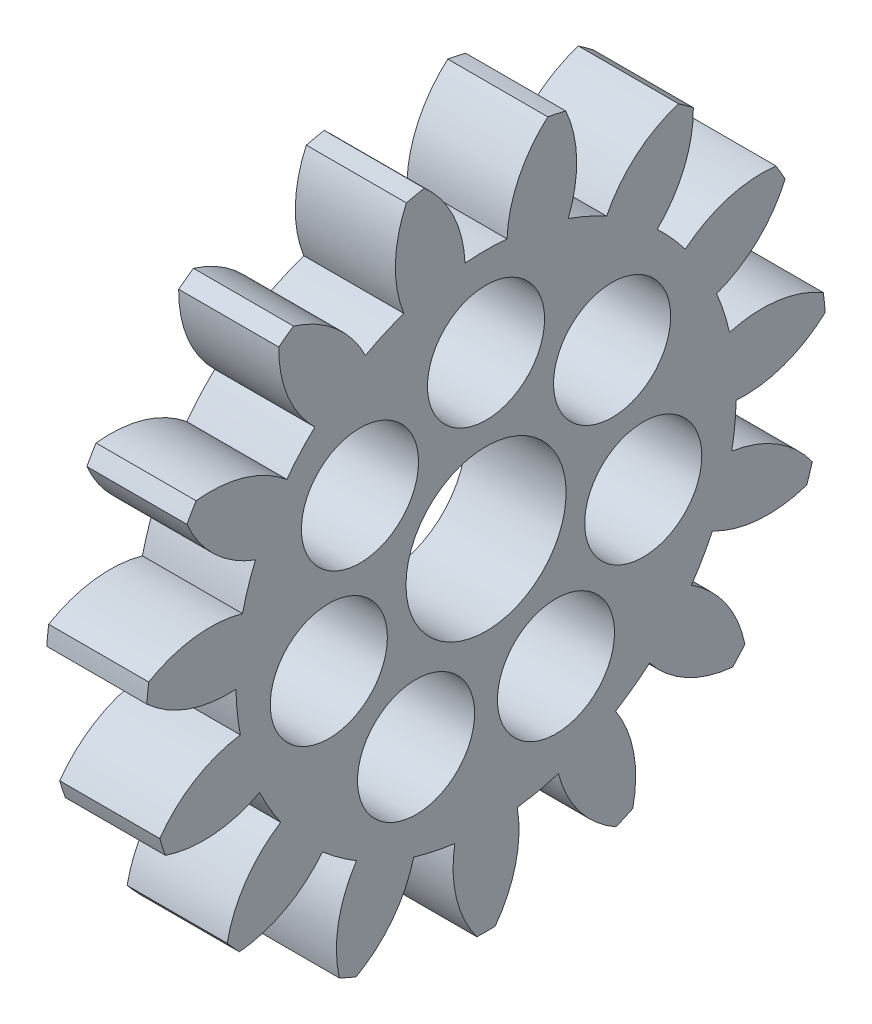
SolidWorks part; units mm, degrees
ref_plane "Plane1" through (0, 0, 0) normal (0, 0, 1) x (1, 0, 0)
ref_plane "Plane2" through (0, 0, 0) normal (0, 1, 0) x (1, 0, 0)
ref_plane "Plane3" through (0, 0, 0) normal (1, 0, 0) x (0, 0, -1)
sketch "HoldingSke" plane through (0, 0, 0) normal (0, 1, 0) x (1, 0, 0)
  line L0 (0, 0) -> (0.483, -0.1294)
  line L1 (-15, 0) -> (100, 0) construction
  line L2 (0, 0) -> (-2.1039, 2.3779)
  line L3 (0, 0) -> (-11.863, 4.5341)
  line L4 (0, 0) -> (8.3417, 2.2352)
  line L5 (0, 0) -> (-46.8476, -17.4728)
  line L6 (0, 0) -> (-4.1448, -2.7965)
  line L7 (-2.1039, 2.3779) -> (8.6586, 51.2059)
  line L8 (-76.2, 54.61) -> (-74.8, 54.61)
  line L9 (-71.009, 38.7566) -> (-53.1078, 45.2721)
  line L10 (-76.2, 71.12) -> (104.1128, 71.12)
  line L11 (0, 0) -> (-5, 0)
  line L12 (-76.2, 101.6) -> (-76.133, 101.6)
  line L13 (24.9733, 27.94) -> (52.9518, 28.4284)
  line L14 (24.9733, 27.94) -> (24.9743, 27.94)
  line L15 (24.9733, 27.94) -> (100.4006, 29.5858)
  line L16 (-63.627, -2) -> (-12.827, -2)
  circle A0 centre (0, 0) radius 4
  circle A1 centre (0, 0) radius 12.499
  circle A2 centre (0, 0) radius 37.5
  circle A3 centre (0, 0) radius 4
sketch "BasProSke" plane through (0, 0, 0) normal (0, 1, 0) x (1, 0, 0)
  line L0 (-10, 0) -> (60, 0) construction
  line L1 (0, 0) -> (0, 17)
  line L2 (0, 0) -> (5, 0)
  line L3 (5, 0) -> (5, 17)
  line L4 (5, 17) -> (0, 17)
revolve "Base-Revolve" add sketch "BasProSke" angle 360 about L0
sketch "TooCutSke" plane through (0, 0, 0) normal (1, 0, 0) x (0, 0, -1)
  line L1 (0, 0) -> (0, 107) construction
  line L2 (0, 0) -> (-1.6851, 14.905) construction
  line L3 (0, 0) -> (-6.2081, 29.2069) construction
  line L4 (-1.6851, 14.905) -> (-3.1041, 14.6034) construction
  arc A0 (1.0501, 12.4548) -> (-1.0501, 12.4548) centre (0, 0) ccw
  arc A1 (3.1109, 16.7388) -> (-3.1109, 16.7388) centre (0, 0) ccw
  circle A2 centre (0, 0) radius 15 construction
  circle A3 centre (0, 0) radius 14.0954 construction
  arc A4 (-1.0501, 12.4548) -> (-3.1109, 16.7388) centre (-7.045, 12.2085) ccw
  arc A5 (3.1109, 16.7388) -> (1.0501, 12.4548) centre (7.045, 12.2085) ccw
extrude "ToothCut" cut sketch "TooCutSke" along normal through all
fillet "Breaks" [suppressed] radius 0.04
fillet "RootFillets" [suppressed] radius 0.501
pattern_circular "TeethCuts" count 15 every 24 about axis through (-10, 0, 0) along (1, 0, 0) of "ToothCut", "RootFillets", "Breaks"
sketch "HubNeaOneSke" plane through (0, 0, 0) normal (-1, 0, 0) x (0, 0, 1)
  circle A0 centre (0, 0) radius 12.499
extrude "HubNearOne" [suppressed] add sketch "HubNeaOneSke" along normal blind 45.0001
sketch "HubNeaBotSke" plane through (0, 0, 0) normal (-1, 0, 0) x (0, 0, 1)
  circle A0 centre (0, 0) radius 12.499
extrude "HubNearBoth" [suppressed] add sketch "HubNeaBotSke" along normal blind 22.5
ref_plane "FarPln" through (5, 0, 0) normal (1, 0, 0) x (0, 0, -1)
sketch "HubFarSke" plane through (5, 0, 0) normal (1, 0, 0) x (0, 0, -1)
  circle A0 centre (0, 0) radius 12.499
extrude "HubFar" [suppressed] add sketch "HubFarSke" along normal blind 22.5
sketch "BorSke" plane through (0, 0, 0) normal (1, 0, 0) x (0, 0, -1)
  circle A0 centre (0, 0) radius 4
extrude "Bore" cut sketch "BorSke" along normal mid plane 100.0001
sketch "KeySke" plane through (0, 0, 0) normal (1, 0, 0) x (0, 0, -1)
  line L0 (-1.5, 0) -> (-1.5, 5.4)
  line L1 (-1.5, 5.4) -> (1.5, 5.4)
  line L2 (1.5, 5.4) -> (1.5, 0)
  line L3 (0, 0) -> (0, 34) construction
  line L4 (-1.5, 0) -> (1.5, 0)
extrude "Keyway" [suppressed] cut sketch "KeySke" along normal mid plane 100.0001
pattern_circular "Keyway2" [suppressed] count 2 every 90 about axis through (-10, 0, 0) along (1, 0, 0)
sketch "Esquisse1" plane through (5, 0, 0) normal (1, 0, 0) x (0, 0, -1)
  circle A0 centre (0, 8.0568) radius 2.9257
  circle A1 centre (6.299, 5.0233) radius 2.9257
  circle A2 centre (7.8548, -1.7928) radius 2.9257
  circle A3 centre (3.4957, -7.2589) radius 2.9257
  circle A4 centre (-3.4957, -7.2589) radius 2.9257
  circle A5 centre (-7.8548, -1.7928) radius 2.9257
  circle A6 centre (-6.299, 5.0233) radius 2.9257
  point P16 (0, 0)
  dimension "D1" = 7
extrude "Enlèv. mat.-Extru.1" cut sketch "Esquisse1" against normal blind 10
equation "' \"Module@HoldingSke\" = 6.35"
equation "' \"Num_teeth@HoldingSke\" = 12"
equation "' \"Ap@HoldingSke\" =  20"
equation "' \"Ap@HoldingSke\" = 20"
equation "' \"Width@HoldingSke\" = 0.5 * 25.4"
equation "' \"Hub_dia@HoldingSke\"= 1 * 25.4"
equation "' \"Hub_dia@HoldingSke\" = 1 * 25.4"
equation "' \"Overall_len@HoldingSke\" = 1.0 * 25.4"
equation "' \"Bore@HoldingSke\" = 0.75 * 25.4"
equation "' \"T_dim@HoldingSke\" = 0.1 * 25.4"
equation "' \"Width@KeySke\" = 0.25 * 25.4"
equation "' \"Show_teeth@HoldingSke\" = 13"
equation "' \"Backlash@HoldingSke\" = 0.009 * 25.4"
equation "' \"Addendum_fac@HoldingSke\" = 1.0"
equation "' \"Dedendum_fac@HoldingSke\" = 1.25"
equation "' \"Dedendum_add@HoldingSke\" = 0.00005 * 25.4"
equation "' \"Clearance_fac@HoldingSke\" = 0.25"
equation "\"Pitch@HoldingSke\" = 1 / \"Module@HoldingSke\""
equation "\"Overcut_dia@TooCutSke\" = (\"Num_teeth@HoldingSke\" + 2 * \"Addendum_fac@HoldingSke\") / \"Pitch@HoldingSke\" + 0.002 * 25.4"
equation "\"Pitch_dia@TooCutSke\" = \"Num_teeth@HoldingSke\" / \"Pitch@HoldingSke\""
equation "\"Base_dia@TooCutSke\" = \"Num_teeth@HoldingSke\" / \"Pitch@HoldingSke\" * cos((\"Ap@HoldingSke\"  * 3.14159265 / 180))"
equation "\"Root_dia@TooCutSke\" = (\"Num_teeth@HoldingSke\" + 2) / \"Pitch@HoldingSke\" - 2 * (\"Addendum_fac@HoldingSke\" + \"Dedendum_fac@HoldingSke\") / \"Pitch@HoldingSke\" - \"Dedendum_add@HoldingSke\" * 2"
equation "\"Half_ang@TooCutSke\" = 180 / \"Num_teeth@HoldingSke\""
equation "\"Half_CT@TooCutSke\" = \"Num_teeth@HoldingSke\" / \"Pitch@HoldingSke\" * sin((3.14159265 / 2 / \"Num_teeth@HoldingSke\")) / 2 - 7 * \"Backlash@HoldingSke\" / 4"
equation "\"Flank_rad@TooCutSke\" = \"Num_teeth@HoldingSke\" / \"Pitch@HoldingSke\" / 5"
equation "\"Radius@RootFillets\" = \"Clearance_fac@HoldingSke\" / \"Pitch@HoldingSke\" + \"Dedendum_add@HoldingSke\""
equation "\"Break_rad@Breaks\" = 0.02 / \"Pitch@HoldingSke\""
equation "\"Thickness@HoldingSke\" = \"Width@HoldingSke\""
equation "\"OAL@HoldingSke\" = \"Thickness@HoldingSke\""
equation "\"MHD@HoldingSke\" = (\"Num_teeth@HoldingSke\" + 2) / \"Pitch@HoldingSke\" - 2 * (\"Addendum_fac@HoldingSke\" + \"Dedendum_fac@HoldingSke\")  / \"Pitch@HoldingSke\" - \"Dedendum_add@HoldingSke\" * 2"
equation "\"MBD@HoldingSke\" = (\"Num_teeth@HoldingSke\" + 2) / \"Pitch@HoldingSke\" - 2 * (\"Addendum_fac@HoldingSke\" + \"Dedendum_fac@HoldingSke\")  / \"Pitch@HoldingSke\" - \"Dedendum_add@HoldingSke\" * 2 - 0.002 * 25.4"
equation "\"MHD@HoldingSke\" = ((sgn( \"MHD@HoldingSke\" - \"Hub_dia@HoldingSke\" )-1)*( \"MHD@HoldingSke\" - \"Hub_dia@HoldingSke\" ))/-2+ \"Hub_dia@HoldingSke\""
equation "\"MBD@HoldingSke\" = ((sgn( \"MBD@HoldingSke\" - \"Bore@HoldingSke\" )-1)*( \"MBD@HoldingSke\" - \"Bore@HoldingSke\" ))/-2+ \"Bore@HoldingSke\""
equation "\"OAL@HoldingSke\" = ((sgn( \"OAL@HoldingSke\" - \"Overall_len@HoldingSke\" )+1)*( \"OAL@HoldingSke\" - \"Overall_len@HoldingSke\" ))/2 + \"Overall_len@HoldingSke\" + 0.000002 * 25.4"
equation "\"Num_teeth@TeethCuts\" = int( \"Show_teeth@HoldingSke\" ) + 1"
equation "\"Num_teeth@TeethCuts\" = ((sgn( \"Num_teeth@TeethCuts\" - \"Num_teeth@HoldingSke\" )-1)*( \"Num_teeth@TeethCuts\" - \"Num_teeth@HoldingSke\" ))/-2+ \"Num_teeth@HoldingSke\""
equation "\"Num_teeth@TeethCuts\" = ((sgn( \"Num_teeth@TeethCuts\" - 2.0)+1)*( \"Num_teeth@TeethCuts\" - 2.0))/2 +2.0"
equation "\"Angle@TeethCuts\" = 360.0 / \"Num_teeth@HoldingSke\""
equation "\"Diameter@BasProSke\" = (\"Num_teeth@HoldingSke\" + 2 * \"Addendum_fac@HoldingSke\") / \"Pitch@HoldingSke\""
equation "\"Thickness@BasProSke\"  = \"Thickness@HoldingSke\""
equation "' \"Fillet_rad@BasProSke\" =  \"Thickness@HoldingSke\" * 0.05"
equation "' \"Fillet_rad@BasProSke\" = \"Thickness@HoldingSke\" * 0.05"
equation "\"MHD@HoldingSke\" = ((sgn( \"MHD@HoldingSke\" - \"Root_dia@TooCutSke\" )-1)*( \"MHD@HoldingSke\" - \"Root_dia@TooCutSke\" ))/-2+ \"Root_dia@TooCutSke\""
equation "\"Diameter@HubNeaOneSke\" = \"MHD@HoldingSke\""
equation "\"Length@HubNearOne\" = \"OAL@HoldingSke\" - \"Thickness@BasProSke\""
equation "\"Diameter@HubNeaBotSke\" = \"MHD@HoldingSke\""
equation "\"Length@HubNearBoth\" = ( \"OAL@HoldingSke\" - \"Thickness@BasProSke\" ) / 2.0"
equation "\"Thickness@FarPln\" = \"Thickness@BasProSke\""
equation "\"Diameter@HubFarSke\" = \"MHD@HoldingSke\""
equation "\"Length@HubFar\" = ( \"OAL@HoldingSke\" - \"Thickness@BasProSke\" ) / 2.0"
equation "\"Diameter@BorSke\" = \"MBD@HoldingSke\""
equation "\"D1@Bore\" = \"OAL@HoldingSke\" * 2.0"
equation "\"D1@Keyway\" = \"OAL@HoldingSke\" * 2.0"
equation "\"Offset@KeySke\" = \"T_dim@HoldingSke\" + \"MBD@HoldingSke\" / 2.0"
